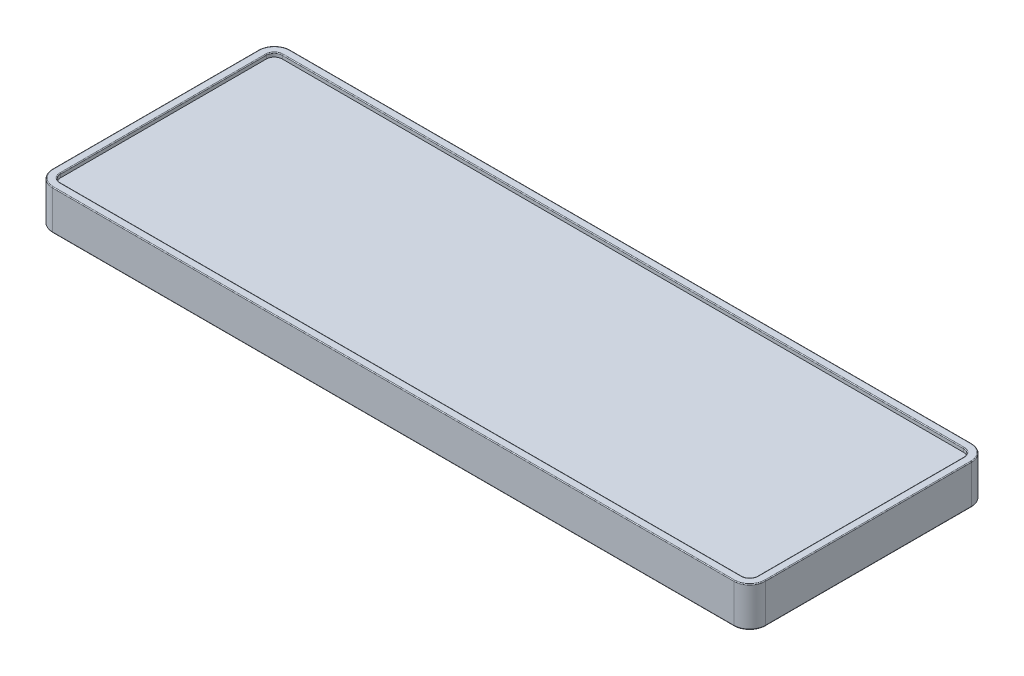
SolidWorks part; units mm, degrees
ref_plane "Alzado" through (0, 0, 0) normal (0, 0, 1) x (1, 0, 0)
ref_plane "Planta" through (0, 0, 0) normal (0, 1, 0) x (1, 0, 0)
ref_plane "Vista lateral" through (0, 0, 0) normal (1, 0, 0) x (0, 0, -1)
sketch "Croquis1" plane through (0, 0, 0) normal (0, 1, 0) x (1, 0, 0)
  line L1 (-430, -150) -> (430, -150)
  line L2 (-450, -130) -> (-450, 130)
  line L3 (-430, 150) -> (430, 150)
  line L4 (450, -130) -> (450, 130)
  line L5 (-450, -150) -> (450, 150) construction
  line L6 (-450, 150) -> (450, -150) construction
  arc A0 (-430, -150) -> (-450, -130) centre (-430, -130) cw
  arc A1 (430, -150) -> (450, -130) centre (430, -130) ccw
  arc A2 (430, 150) -> (450, 130) centre (430, 130) cw
  arc A3 (-450, 130) -> (-430, 150) centre (-430, 130) cw
  point P0 (0, 0)
  dimension "D3" = 20
  dimension "D1" = 300
  dimension "D2" = 900
extrude "Saliente-Extruir1" add sketch "Croquis1" along normal blind 50
sketch "Croquis2" plane through (0, 50, 0) normal (0, 1, 0) x (1, 0, 0)
  line L8 (-430, -140) -> (430, -140)
  line L9 (440, -130) -> (440, 130)
  line L10 (430, 140) -> (-430, 140)
  line L11 (-440, 130) -> (-440, -130)
  line L12 (-430, -140) -> (430, -140)
  line L13 (440, -130) -> (440, 130)
  line L14 (430, 140) -> (-430, 140)
  line L15 (-440, 130) -> (-440, -130)
  arc A8 (-440, -130) -> (-430, -140) centre (-430, -130) ccw
  arc A9 (430, -140) -> (440, -130) centre (430, -130) ccw
  arc A10 (440, 130) -> (430, 140) centre (430, 130) ccw
  arc A11 (-430, 140) -> (-440, 130) centre (-430, 130) ccw
  arc A12 (-440, -130) -> (-430, -140) centre (-430, -130) ccw
  arc A13 (430, -140) -> (440, -130) centre (430, -130) ccw
  arc A14 (440, 130) -> (430, 140) centre (430, 130) ccw
  arc A15 (-430, 140) -> (-440, 130) centre (-430, 130) ccw
  dimension "D1" = 10
extrude "Cortar-Extruir1" cut sketch "Croquis2" against normal blind 5
shell "Vaciado1" thickness 10
fillet "Redondeo1" radius 1 16 edges at (-450, 50, 0) (-444.1421, 50, -144.1421) (0, 50, -150) (444.1421, 50, -144.1421) (450, 50, 0) (444.1421, 50, 144.1421) (0, 50, 150) (-444.1421, 50, 144.1421) (437.0711, 50, 137.0711) (440, 50, 0) (437.0711, 50, -137.0711) (0, 50, -140) (-437.0711, 50, -137.0711) (-440, 50, 0) (-437.0711, 50, 137.0711) (0, 50, 140)
fillet "Redondeo2" radius 1 16 edges at (-437.0711, 0, -137.0711) (0, 0, -140) (437.0711, 0, -137.0711) (440, 0, 0) (437.0711, 0, 137.0711) (0, 0, 140) (-437.0711, 0, 137.0711) (-440, 0, 0) (0, 0, 150) (444.1421, 0, 144.1421) (450, 0, 0) (444.1421, 0, -144.1421) (0, 0, -150) (-444.1421, 0, -144.1421) (-450, 0, 0) (-444.1421, 0, 144.1421)
